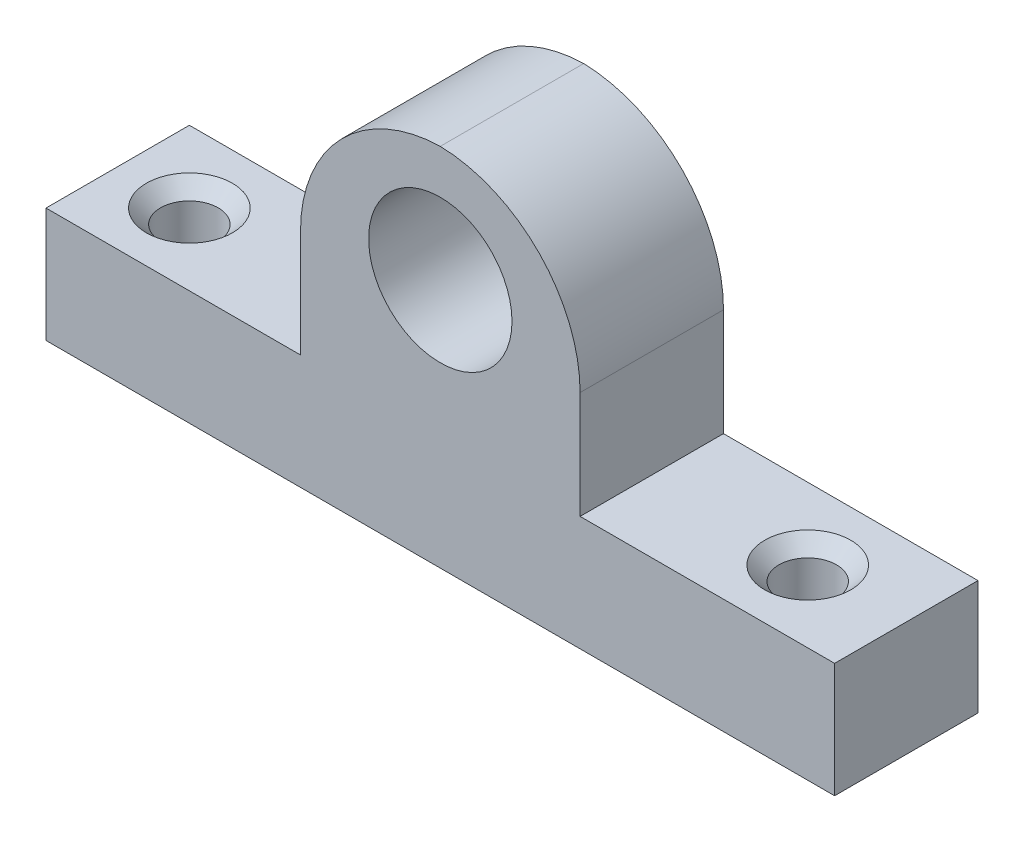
SolidWorks part; units mm, degrees
ref_plane "Front Plane" through (0, 0, 0) normal (0, 0, 1) x (1, 0, 0)
ref_plane "Top Plane" through (0, 0, 0) normal (0, 1, 0) x (1, 0, 0)
ref_plane "Right Plane" through (0, 0, 0) normal (1, 0, 0) x (0, 0, -1)
sketch "Sketch2" plane through (0, 0, 0) normal (0, 0, 1) x (1, 0, 0)
  line L4 (0, 0) -> (69.85, 0)
  line L7 (0, 0) -> (0, 10.16)
  line L8 (0, 10.16) -> (69.85, 10.16)
  line L9 (69.85, 0) -> (69.85, 10.16)
  line L10 (34.925, 10.16) -> (0, 10.16)
  line L11 (17.4625, 10.16) -> (17.4625, 29.21)
  line L12 (34.925, 10.16) -> (69.85, 10.16)
  line L14 (69.85, 10.16) -> (34.925, 10.16)
  line L16 (52.3875, 10.16) -> (52.3875, 29.21)
  line L25 (17.4625, 10.16) -> (52.3875, 10.16)
  line L26 (17.4625, 10.16) -> (17.4625, 32.3596)
  line L27 (17.4625, 32.3596) -> (52.3875, 32.3596)
  line L28 (52.3875, 10.16) -> (52.3875, 32.3596)
  dimension "D1" = 69.85
  dimension "D2" = 10.16
  dimension "D3" = 19.05
extrude "Boss-Extrude1" add sketch "Sketch2" along normal blind 12.7 contours L7 L4 L9 L8 | L26 L25 L28 L27
sketch "Sketch10" plane through (0, 10.16, 0) normal (0, 1, 0) x (1, 0, 0)
  line L0 (69.85, 0) -> (52.3875, 0)
  line L1 (52.3875, 0) -> (61.1187, 0)
  line L2 (0, 0) -> (6.35, -6.35)
  line L3 (52.3875, -12.7) -> (69.85, -12.7) construction
  line L4 (61.1187, -12.7) -> (61.1187, -6.35)
  line L7 (6.35, -6.35) -> (61.1187, -6.35)
  point P9 (61.1187, -6.35)
  point P10 (6.35, -6.35)
hole_wizard "1/4-20 Tapped Hole2" positions "Sketch10" profile "Sketch11" tap size "1/4-20" standard "ANSI Inch"
sketch "Sketch11" plane through (6.35, 10.16, 6.35) normal (1, 0, 0) x (0, 0, 1)
  line L0 (0, 0) -> (0, 10.16)
  line L1 (0, 10.16) -> (2.5527, 10.16)
  line L2 (2.5527, 10.16) -> (2.5527, 1.2573)
  line L3 (2.5527, 1.2573) -> (3.81, 0)
  line L5 (3.81, 0) -> (0, 0)
  line L6 (-2.5527, 1.2573) -> (-3.81, 0) construction
  line L11 (0, -6.35) -> (0, 107.95) construction
  dimension "Thru Tap Drill Dia." = 5.1054
  dimension "Thru Tap Drill Depth" = 10.16
  dimension "Near C'Sink Dia." = 7.62
  dimension "Near C'Sink Angle" = 90
sketch "Sketch12" plane through (0, 0, 12.7) normal (0, 0, 1) x (1, 0, 0)
  line L1 (17.4625, 32.3596) -> (22.5425, 32.3596)
  line L2 (17.4625, 32.3596) -> (17.4625, 10.16)
  line L3 (17.4625, 10.16) -> (22.5425, 10.16)
  line L4 (22.5425, 32.3596) -> (22.5425, 10.16)
  line L5 (52.3875, 32.3596) -> (47.3075, 32.3596)
  line L6 (52.3875, 32.3596) -> (52.3875, 10.16)
  line L7 (52.3875, 10.16) -> (47.3075, 10.16)
  line L8 (47.3075, 32.3596) -> (47.3075, 10.16)
  dimension "D1" = 5.08
  dimension "D2" = 5.08
extrude "Cut-Extrude1" cut sketch "Sketch12" against normal through all contours L2 L1 L4 L3 | L6 L5 L8 L7
fillet "Fillet1" radius 12.7 2 edges at (47.3075, 32.3596, 6.35) (22.5425, 32.3596, 6.35)
sketch "Sketch14" plane through (0, 0, 12.7) normal (0, 0, 1) x (1, 0, 0)
  line L0 (34.925, 32.3556) -> (34.925, 22.1011)
  circle A0 centre (34.925, 22.1011) radius 6.35
  dimension "D1" = 12.7
extrude "Cut-Extrude2" cut sketch "Sketch14" against normal through all contours A0
